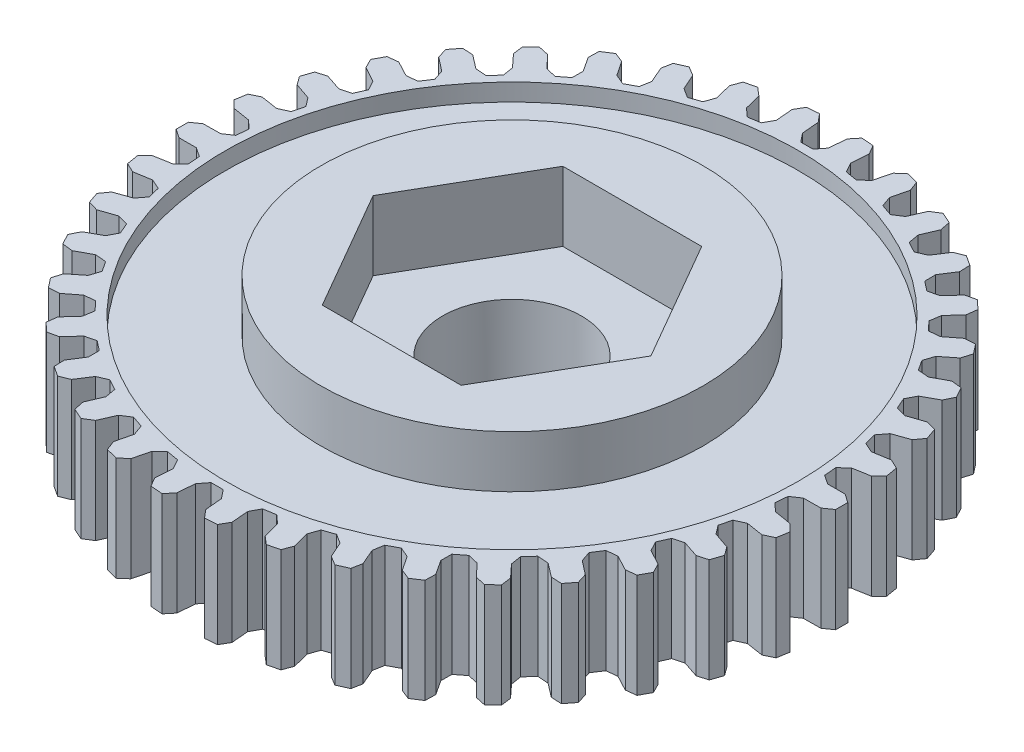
SolidWorks part; units mm, degrees
ref_plane "Front" through (0, 0, 0) normal (0, 0, 1) x (1, 0, 0)
ref_plane "Top" through (0, 0, 0) normal (0, 1, 0) x (1, 0, 0)
ref_plane "Right" through (0, 0, 0) normal (1, 0, 0) x (0, 0, -1)
sketch "Sketch1" plane through (0, 0, 0) normal (0, 0, 1) x (1, 0, 0)
  line L0 (0, 0) -> (0, 4)
  line L2 (8.25, 3) -> (8.25, 2.5)
  line L3 (9.5, 3) -> (8.25, 3)
  line L4 (9.5, 0) -> (9.5, 3)
  line L5 (8.25, 2.5) -> (5.5, 2.5)
  line L6 (5.5, 2.5) -> (5.5, 4)
  line L7 (0, 4) -> (5.5, 4)
  line L8 (9.5, 0) -> (8.25, 0)
  line L9 (8.25, 0) -> (8.25, 0.5)
  line L10 (8.25, 0.5) -> (5.25, 0.5)
  line L11 (5.25, 0.5) -> (5.25, 0)
  line L12 (5.25, 0) -> (0, 0)
  dimension "D1" = 3
  dimension "D2" = 1.5
  dimension "D3" = 4
  dimension "D4" = 5.5
  dimension "D5" = 1.25
  dimension "D6" = 9.5
  dimension "D7" = 3
  dimension "D8" = 1.25
  dimension "D9" = 0.5
  dimension "D10" = 5.25
  dimension "D11" = 0.5
revolve "Revolve1" add sketch "Sketch1" angle 360 about L0
sketch "Sketch3" plane through (0, 3, 0) normal (0, 1, 0) x (-1, 0, 0)
  line L0 (2.1568, 9.2453) -> (1.9273, 9.0458)
  line L1 (1.9273, 9.0458) -> (1.8053, 8.5613)
  line L2 (1.8053, 8.5613) -> (1.5711, 8.348)
  line L3 (1.5711, 8.348) -> (1.2246, 8.4058)
  line L4 (1.2246, 8.4058) -> (1.0699, 8.6838)
  line L5 (1.0699, 8.6838) -> (1.1068, 9.1821)
  line L6 (1.1068, 9.1821) -> (0.9521, 9.4455)
  line L7 (0.9521, 9.4455) -> (0.6057, 9.4742)
  line L8 (0.6057, 9.4742) -> (0.4122, 9.2396)
  line L9 (0.4122, 9.2396) -> (0.3716, 8.7417)
  line L10 (0.3716, 8.7417) -> (0.1756, 8.4927)
  line L11 (0.1756, 8.4927) -> (-0.1756, 8.4927)
  line L12 (-0.1756, 8.4927) -> (-0.3741, 8.7415)
  line L13 (-0.3741, 8.7415) -> (-0.4196, 9.239)
  line L14 (-0.4196, 9.239) -> (-0.6156, 9.4734)
  line L15 (-0.6156, 9.4734) -> (-0.962, 9.4447)
  line L16 (3.6491, 8.7642) -> (3.3899, 8.6052)
  line L17 (3.3899, 8.6052) -> (3.1899, 8.1474)
  line L18 (3.1899, 8.1474) -> (2.9237, 7.9756)
  line L19 (2.9237, 7.9756) -> (2.5915, 8.0896)
  line L20 (2.5915, 8.0896) -> (2.4846, 8.3893)
  line L21 (2.4846, 8.3893) -> (2.603, 8.8747)
  line L22 (2.603, 8.8747) -> (2.4937, 9.16)
  line L23 (2.4937, 9.16) -> (2.1568, 9.2453)
  line L24 (5.0419, 8.0441) -> (4.7601, 7.9298)
  line L25 (4.7601, 7.9298) -> (4.4874, 7.5113)
  line L26 (4.4874, 7.5113) -> (4.1966, 7.3855)
  line L27 (4.1966, 7.3855) -> (3.8876, 7.5527)
  line L28 (3.8876, 7.5527) -> (3.8315, 7.8659)
  line L29 (3.8315, 7.8659) -> (4.0282, 8.3252)
  line L30 (4.0282, 8.3252) -> (3.9674, 8.6246)
  line L31 (3.9674, 8.6246) -> (3.6491, 8.7642)
  line L32 (6.2971, 7.1045) -> (6.0003, 7.0382)
  line L33 (6.0003, 7.0382) -> (5.6625, 6.6702)
  line L34 (5.6625, 6.6702) -> (5.3549, 6.5941)
  line L35 (5.3549, 6.5941) -> (5.0778, 6.8098)
  line L36 (5.0778, 6.8098) -> (5.074, 7.128)
  line L37 (5.074, 7.128) -> (5.3436, 7.5486)
  line L38 (5.3436, 7.5486) -> (5.3329, 7.854)
  line L39 (5.3329, 7.854) -> (5.0419, 8.0441)
  line L40 (7.3806, 5.9711) -> (7.077, 5.9546)
  line L41 (7.077, 5.9546) -> (6.6831, 5.6472)
  line L42 (6.6831, 5.6472) -> (6.3673, 5.6228)
  line L43 (6.3673, 5.6228) -> (6.1294, 5.8812)
  line L44 (6.1294, 5.8812) -> (6.178, 6.1957)
  line L45 (6.178, 6.1957) -> (6.5131, 6.5661)
  line L46 (6.5131, 6.5661) -> (6.5529, 6.8691)
  line L47 (6.5529, 6.8691) -> (6.2971, 7.1045)
  line L48 (8.2628, 4.6749) -> (7.9605, 4.7086)
  line L49 (7.9605, 4.7086) -> (7.5215, 4.4702)
  line L50 (7.5215, 4.4702) -> (7.2059, 4.4981)
  line L51 (7.2059, 4.4981) -> (7.0138, 4.7921)
  line L52 (7.0138, 4.7921) -> (7.1135, 5.0943)
  line L53 (7.1135, 5.0943) -> (7.5051, 5.4046)
  line L54 (7.5051, 5.4046) -> (7.5941, 5.6968)
  line L55 (7.5941, 5.6968) -> (7.3806, 5.9711)
  line L56 (8.9195, 3.2511) -> (8.627, 3.3341)
  line L57 (8.627, 3.3341) -> (8.1547, 3.1712)
  line L58 (8.1547, 3.1712) -> (7.848, 3.2507)
  line L59 (7.848, 3.2507) -> (7.7069, 3.5723)
  line L60 (7.7069, 3.5723) -> (7.855, 3.854)
  line L61 (7.855, 3.854) -> (8.2923, 4.0955)
  line L62 (8.2923, 4.0955) -> (8.4282, 4.3692)
  line L63 (8.4282, 4.3692) -> (8.2628, 4.6749)
  line L64 (9.333, 1.7387) -> (9.0581, 1.8687)
  line L65 (9.0581, 1.8687) -> (8.5654, 1.7858)
  line L66 (8.5654, 1.7858) -> (8.276, 1.9146)
  line L67 (8.276, 1.9146) -> (8.1897, 2.2551)
  line L68 (8.1897, 2.2551) -> (8.3822, 2.5085)
  line L69 (8.3822, 2.5085) -> (8.8533, 2.6748)
  line L70 (8.8533, 2.6748) -> (9.0324, 2.9224)
  line L71 (9.0324, 2.9224) -> (8.9195, 3.2511)
  line L72 (9.4919, 0.1788) -> (9.2421, 0.3523)
  line L73 (9.2421, 0.3523) -> (8.7425, 0.3516)
  line L74 (8.7425, 0.3516) -> (8.4782, 0.5263)
  line L75 (8.4782, 0.5263) -> (8.4492, 0.8764)
  line L76 (8.4492, 0.8764) -> (8.6807, 1.0946)
  line L77 (8.6807, 1.0946) -> (9.1728, 1.1811)
  line L78 (9.1728, 1.1811) -> (9.3902, 1.3958)
  line L79 (9.3902, 1.3958) -> (9.333, 1.7387)
  line L80 (9.3919, -1.386) -> (9.174, -1.1737)
  line L81 (9.174, -1.1737) -> (8.6812, -1.0922)
  line L82 (8.6812, -1.0922) -> (8.4492, -0.8764)
  line L83 (8.4492, -0.8764) -> (8.4782, -0.5263)
  line L84 (8.4782, -0.5263) -> (8.7425, -0.3491)
  line L85 (8.7425, -0.3491) -> (9.2421, -0.3448)
  line L86 (9.2421, -0.3448) -> (9.4919, -0.1688)
  line L87 (9.4919, -0.1688) -> (9.4919, 0.1788)
  line L88 (9.0356, -2.9129) -> (8.8557, -2.6677)
  line L89 (8.8557, -2.6677) -> (8.383, -2.5062)
  line L90 (8.383, -2.5062) -> (8.1897, -2.2551)
  line L91 (8.1897, -2.2551) -> (8.276, -1.9146)
  line L92 (8.276, -1.9146) -> (8.5658, -1.7833)
  line L93 (8.5658, -1.7833) -> (9.0593, -1.8613)
  line L94 (9.0593, -1.8613) -> (9.3346, -1.7288)
  line L95 (9.3346, -1.7288) -> (9.3919, -1.386)
  line L96 (8.433, -4.3604) -> (8.2958, -4.089)
  line L97 (8.2958, -4.089) -> (7.8562, -3.8518)
  line L98 (7.8562, -3.8518) -> (7.7069, -3.5723)
  line L99 (7.7069, -3.5723) -> (7.848, -3.2507)
  line L100 (7.848, -3.2507) -> (8.1555, -3.1689)
  line L101 (8.1555, -3.1689) -> (8.6294, -3.327)
  line L102 (8.6294, -3.327) -> (8.9228, -3.2417)
  line L103 (8.9228, -3.2417) -> (9.0356, -2.9129)
  line L104 (7.6002, -5.6889) -> (7.5097, -5.3986)
  line L105 (7.5097, -5.3986) -> (7.115, -5.0923)
  line L106 (7.115, -5.0923) -> (7.0138, -4.7921)
  line L107 (7.0138, -4.7921) -> (7.2059, -4.4981)
  line L108 (7.2059, -4.4981) -> (7.5227, -4.468)
  line L109 (7.5227, -4.468) -> (7.9641, -4.702)
  line L110 (7.9641, -4.702) -> (8.2675, -4.6661)
  line L111 (8.2675, -4.6661) -> (8.433, -4.3604)
  line L112 (6.5602, -6.8623) -> (6.5187, -6.5611)
  line L113 (6.5187, -6.5611) -> (6.1798, -6.194)
  line L114 (6.1798, -6.194) -> (6.1294, -5.8812)
  line L115 (6.1294, -5.8812) -> (6.3673, -5.6228)
  line L116 (6.3673, -5.6228) -> (6.6847, -5.6453)
  line L117 (6.6847, -5.6453) -> (7.0816, -5.9487)
  line L118 (7.0816, -5.9487) -> (7.3868, -5.9632)
  line L119 (7.3868, -5.9632) -> (7.6002, -5.6889)
  line L120 (5.3412, -7.8485) -> (5.3498, -7.5445)
  line L121 (5.3498, -7.5445) -> (5.0761, -7.1266)
  line L122 (5.0761, -7.1266) -> (5.0778, -6.8098)
  line L123 (5.0778, -6.8098) -> (5.3549, -6.5941)
  line L124 (5.3549, -6.5941) -> (5.6643, -6.6685)
  line L125 (5.6643, -6.6685) -> (6.0059, -7.0331)
  line L126 (6.0059, -7.0331) -> (6.3045, -7.0977)
  line L127 (6.3045, -7.0977) -> (6.5602, -6.8623)
  line L128 (3.9766, -8.6206) -> (4.0351, -8.3222)
  line L129 (4.0351, -8.3222) -> (3.8338, -7.8649)
  line L130 (3.8338, -7.8649) -> (3.8876, -7.5527)
  line L131 (3.8876, -7.5527) -> (4.1966, -7.3855)
  line L132 (4.1966, -7.3855) -> (4.4895, -7.5099)
  line L133 (4.4895, -7.5099) -> (4.7663, -7.9257)
  line L134 (4.7663, -7.9257) -> (5.0503, -8.0386)
  line L135 (5.0503, -8.0386) -> (5.3412, -7.8485)
  line L136 (2.5034, -9.1575) -> (2.6103, -8.8728)
  line L137 (2.6103, -8.8728) -> (2.487, -8.3887)
  line L138 (2.487, -8.3887) -> (2.5915, -8.0896)
  line L139 (2.5915, -8.0896) -> (2.9237, -7.9756)
  line L140 (2.9237, -7.9756) -> (3.1921, -8.1464)
  line L141 (3.1921, -8.1464) -> (3.3968, -8.6022)
  line L142 (3.3968, -8.6022) -> (3.6583, -8.7602)
  line L143 (3.6583, -8.7602) -> (3.9766, -8.6206)
  line L144 (0.962, -9.4447) -> (1.1143, -9.1814)
  line L145 (1.1143, -9.1814) -> (1.0723, -8.6836)
  line L146 (1.0723, -8.6836) -> (1.2246, -8.4058)
  line L147 (1.2246, -8.4058) -> (1.5711, -8.348)
  line L148 (1.5711, -8.348) -> (1.8078, -8.5607)
  line L149 (1.8078, -8.5607) -> (1.9346, -9.0439)
  line L150 (1.9346, -9.0439) -> (2.1665, -9.2429)
  line L151 (2.1665, -9.2429) -> (2.5034, -9.1575)
  line L152 (-0.6057, -9.4742) -> (-0.4122, -9.2396)
  line L153 (-0.4122, -9.2396) -> (-0.3716, -8.7417)
  line L154 (-0.3716, -8.7417) -> (-0.1756, -8.4927)
  line L155 (-0.1756, -8.4927) -> (0.1756, -8.4927)
  line L156 (0.1756, -8.4927) -> (0.3741, -8.7415)
  line L157 (0.3741, -8.7415) -> (0.4196, -9.239)
  line L158 (0.4196, -9.239) -> (0.6156, -9.4734)
  line L159 (0.6156, -9.4734) -> (0.962, -9.4447)
  line L160 (-2.1568, -9.2453) -> (-1.9273, -9.0458)
  line L161 (-1.9273, -9.0458) -> (-1.8053, -8.5613)
  line L162 (-1.8053, -8.5613) -> (-1.5711, -8.348)
  line L163 (-1.5711, -8.348) -> (-1.2246, -8.4058)
  line L164 (-1.2246, -8.4058) -> (-1.0699, -8.6838)
  line L165 (-1.0699, -8.6838) -> (-1.1068, -9.1821)
  line L166 (-1.1068, -9.1821) -> (-0.9521, -9.4455)
  line L167 (-0.9521, -9.4455) -> (-0.6057, -9.4742)
  line L168 (-3.6491, -8.7642) -> (-3.3899, -8.6052)
  line L169 (-3.3899, -8.6052) -> (-3.1899, -8.1474)
  line L170 (-3.1899, -8.1474) -> (-2.9237, -7.9756)
  line L171 (-2.9237, -7.9756) -> (-2.5915, -8.0896)
  line L172 (-2.5915, -8.0896) -> (-2.4846, -8.3893)
  line L173 (-2.4846, -8.3893) -> (-2.603, -8.8747)
  line L174 (-2.603, -8.8747) -> (-2.4937, -9.16)
  line L175 (-2.4937, -9.16) -> (-2.1568, -9.2453)
  line L176 (-5.0419, -8.0441) -> (-4.7601, -7.9298)
  line L177 (-4.7601, -7.9298) -> (-4.4874, -7.5113)
  line L178 (-4.4874, -7.5113) -> (-4.1966, -7.3855)
  line L179 (-4.1966, -7.3855) -> (-3.8876, -7.5527)
  line L180 (-3.8876, -7.5527) -> (-3.8315, -7.8659)
  line L181 (-3.8315, -7.8659) -> (-4.0282, -8.3252)
  line L182 (-4.0282, -8.3252) -> (-3.9674, -8.6246)
  line L183 (-3.9674, -8.6246) -> (-3.6491, -8.7642)
  line L184 (-6.2971, -7.1045) -> (-6.0003, -7.0382)
  line L185 (-6.0003, -7.0382) -> (-5.6625, -6.6702)
  line L186 (-5.6625, -6.6702) -> (-5.3549, -6.5941)
  line L187 (-5.3549, -6.5941) -> (-5.0778, -6.8098)
  line L188 (-5.0778, -6.8098) -> (-5.074, -7.128)
  line L189 (-5.074, -7.128) -> (-5.3436, -7.5486)
  line L190 (-5.3436, -7.5486) -> (-5.3329, -7.854)
  line L191 (-5.3329, -7.854) -> (-5.0419, -8.0441)
  line L192 (-7.3806, -5.9711) -> (-7.077, -5.9546)
  line L193 (-7.077, -5.9546) -> (-6.6831, -5.6472)
  line L194 (-6.6831, -5.6472) -> (-6.3673, -5.6228)
  line L195 (-6.3673, -5.6228) -> (-6.1294, -5.8812)
  line L196 (-6.1294, -5.8812) -> (-6.178, -6.1957)
  line L197 (-6.178, -6.1957) -> (-6.5131, -6.5661)
  line L198 (-6.5131, -6.5661) -> (-6.5529, -6.8691)
  line L199 (-6.5529, -6.8691) -> (-6.2971, -7.1045)
  line L200 (-8.2628, -4.6749) -> (-7.9605, -4.7086)
  line L201 (-7.9605, -4.7086) -> (-7.5215, -4.4702)
  line L202 (-7.5215, -4.4702) -> (-7.2059, -4.4981)
  line L203 (-7.2059, -4.4981) -> (-7.0138, -4.7921)
  line L204 (-7.0138, -4.7921) -> (-7.1135, -5.0943)
  line L205 (-7.1135, -5.0943) -> (-7.5051, -5.4046)
  line L206 (-7.5051, -5.4046) -> (-7.5941, -5.6968)
  line L207 (-7.5941, -5.6968) -> (-7.3806, -5.9711)
  line L208 (-8.9195, -3.2511) -> (-8.627, -3.3341)
  line L209 (-8.627, -3.3341) -> (-8.1547, -3.1712)
  line L210 (-8.1547, -3.1712) -> (-7.848, -3.2507)
  line L211 (-7.848, -3.2507) -> (-7.7069, -3.5723)
  line L212 (-7.7069, -3.5723) -> (-7.855, -3.854)
  line L213 (-7.855, -3.854) -> (-8.2923, -4.0955)
  line L214 (-8.2923, -4.0955) -> (-8.4282, -4.3692)
  line L215 (-8.4282, -4.3692) -> (-8.2628, -4.6749)
  line L216 (-9.333, -1.7387) -> (-9.0581, -1.8687)
  line L217 (-9.0581, -1.8687) -> (-8.5654, -1.7858)
  line L218 (-8.5654, -1.7858) -> (-8.276, -1.9146)
  line L219 (-8.276, -1.9146) -> (-8.1897, -2.2551)
  line L220 (-8.1897, -2.2551) -> (-8.3822, -2.5085)
  line L221 (-8.3822, -2.5085) -> (-8.8533, -2.6748)
  line L222 (-8.8533, -2.6748) -> (-9.0324, -2.9224)
  line L223 (-9.0324, -2.9224) -> (-8.9195, -3.2511)
  line L224 (-9.4919, -0.1788) -> (-9.2421, -0.3523)
  line L225 (-9.2421, -0.3523) -> (-8.7425, -0.3516)
  line L226 (-8.7425, -0.3516) -> (-8.4782, -0.5263)
  line L227 (-8.4782, -0.5263) -> (-8.4492, -0.8764)
  line L228 (-8.4492, -0.8764) -> (-8.6807, -1.0946)
  line L229 (-8.6807, -1.0946) -> (-9.1728, -1.1811)
  line L230 (-9.1728, -1.1811) -> (-9.3902, -1.3958)
  line L231 (-9.3902, -1.3958) -> (-9.333, -1.7387)
  line L232 (-9.3919, 1.386) -> (-9.174, 1.1737)
  line L233 (-9.174, 1.1737) -> (-8.6812, 1.0922)
  line L234 (-8.6812, 1.0922) -> (-8.4492, 0.8764)
  line L235 (-8.4492, 0.8764) -> (-8.4782, 0.5263)
  line L236 (-8.4782, 0.5263) -> (-8.7425, 0.3491)
  line L237 (-8.7425, 0.3491) -> (-9.2421, 0.3448)
  line L238 (-9.2421, 0.3448) -> (-9.4919, 0.1688)
  line L239 (-9.4919, 0.1688) -> (-9.4919, -0.1788)
  line L240 (-9.0356, 2.9129) -> (-8.8557, 2.6677)
  line L241 (-8.8557, 2.6677) -> (-8.383, 2.5062)
  line L242 (-8.383, 2.5062) -> (-8.1897, 2.2551)
  line L243 (-8.1897, 2.2551) -> (-8.276, 1.9146)
  line L244 (-8.276, 1.9146) -> (-8.5658, 1.7833)
  line L245 (-8.5658, 1.7833) -> (-9.0593, 1.8613)
  line L246 (-9.0593, 1.8613) -> (-9.3346, 1.7288)
  line L247 (-9.3346, 1.7288) -> (-9.3919, 1.386)
  line L248 (-8.433, 4.3604) -> (-8.2958, 4.089)
  line L249 (-8.2958, 4.089) -> (-7.8562, 3.8518)
  line L250 (-7.8562, 3.8518) -> (-7.7069, 3.5723)
  line L251 (-7.7069, 3.5723) -> (-7.848, 3.2507)
  line L252 (-7.848, 3.2507) -> (-8.1555, 3.1689)
  line L253 (-8.1555, 3.1689) -> (-8.6294, 3.327)
  line L254 (-8.6294, 3.327) -> (-8.9228, 3.2417)
  line L255 (-8.9228, 3.2417) -> (-9.0356, 2.9129)
  line L256 (-7.6002, 5.6889) -> (-7.5097, 5.3986)
  line L257 (-7.5097, 5.3986) -> (-7.115, 5.0923)
  line L258 (-7.115, 5.0923) -> (-7.0138, 4.7921)
  line L259 (-7.0138, 4.7921) -> (-7.2059, 4.4981)
  line L260 (-7.2059, 4.4981) -> (-7.5227, 4.468)
  line L261 (-7.5227, 4.468) -> (-7.9641, 4.702)
  line L262 (-7.9641, 4.702) -> (-8.2675, 4.6661)
  line L263 (-8.2675, 4.6661) -> (-8.433, 4.3604)
  line L264 (-6.5602, 6.8623) -> (-6.5187, 6.5611)
  line L265 (-6.5187, 6.5611) -> (-6.1798, 6.194)
  line L266 (-6.1798, 6.194) -> (-6.1294, 5.8812)
  line L267 (-6.1294, 5.8812) -> (-6.3673, 5.6228)
  line L268 (-6.3673, 5.6228) -> (-6.6847, 5.6453)
  line L269 (-6.6847, 5.6453) -> (-7.0816, 5.9487)
  line L270 (-7.0816, 5.9487) -> (-7.3868, 5.9632)
  line L271 (-7.3868, 5.9632) -> (-7.6002, 5.6889)
  line L272 (-5.3412, 7.8485) -> (-5.3498, 7.5445)
  line L273 (-5.3498, 7.5445) -> (-5.0761, 7.1266)
  line L274 (-5.0761, 7.1266) -> (-5.0778, 6.8098)
  line L275 (-5.0778, 6.8098) -> (-5.3549, 6.5941)
  line L276 (-5.3549, 6.5941) -> (-5.6643, 6.6685)
  line L277 (-5.6643, 6.6685) -> (-6.0059, 7.0331)
  line L278 (-6.0059, 7.0331) -> (-6.3045, 7.0977)
  line L279 (-6.3045, 7.0977) -> (-6.5602, 6.8623)
  line L280 (-3.9766, 8.6206) -> (-4.0351, 8.3222)
  line L281 (-4.0351, 8.3222) -> (-3.8338, 7.8649)
  line L282 (-3.8338, 7.8649) -> (-3.8876, 7.5527)
  line L283 (-3.8876, 7.5527) -> (-4.1966, 7.3855)
  line L284 (-4.1966, 7.3855) -> (-4.4895, 7.5099)
  line L285 (-4.4895, 7.5099) -> (-4.7663, 7.9257)
  line L286 (-4.7663, 7.9257) -> (-5.0503, 8.0386)
  line L287 (-5.0503, 8.0386) -> (-5.3412, 7.8485)
  line L288 (-2.5034, 9.1575) -> (-2.6103, 8.8728)
  line L289 (-2.6103, 8.8728) -> (-2.487, 8.3887)
  line L290 (-2.487, 8.3887) -> (-2.5915, 8.0896)
  line L291 (-2.5915, 8.0896) -> (-2.9237, 7.9756)
  line L292 (-2.9237, 7.9756) -> (-3.1921, 8.1464)
  line L293 (-3.1921, 8.1464) -> (-3.3968, 8.6022)
  line L294 (-3.3968, 8.6022) -> (-3.6583, 8.7602)
  line L295 (-3.6583, 8.7602) -> (-3.9766, 8.6206)
  line L296 (-0.962, 9.4447) -> (-1.1143, 9.1814)
  line L297 (-1.1143, 9.1814) -> (-1.0723, 8.6836)
  line L298 (-1.0723, 8.6836) -> (-1.2246, 8.4058)
  line L299 (-1.2246, 8.4058) -> (-1.5711, 8.348)
  line L300 (-1.5711, 8.348) -> (-1.8078, 8.5607)
  line L301 (-1.8078, 8.5607) -> (-1.9346, 9.0439)
  line L302 (-1.9346, 9.0439) -> (-2.1665, 9.2429)
  line L303 (-2.1665, 9.2429) -> (-2.5034, 9.1575)
  circle A0 centre (0, 0) radius 9.5
extrude "Cut-Extrude2" cut sketch "Sketch3" against normal through all
sketch "Sketch6" plane through (0, 4, 0) normal (0, 1, 0) x (-1, 0, 0)
  circle A0 centre (0, 0) radius 2
extrude "Cut-Extrude5" cut sketch "Sketch6" against normal through all
sketch "Sketch7" plane through (0, 4, 0) normal (0, 1, 0) x (-1, 0, 0)
  line L1 (-4, 0) -> (-2, -3.4641)
  line L2 (-2, -3.4641) -> (2, -3.4641)
  line L3 (2, -3.4641) -> (4, 0)
  line L4 (4, 0) -> (2, 3.4641)
  line L5 (2, 3.4641) -> (-2, 3.4641)
  line L6 (-2, 3.4641) -> (-4, 0)
  circle A0 centre (0, 0) radius 3.4641 construction
  dimension "D1" = 4
extrude "Cut-Extrude6" cut sketch "Sketch7" against normal blind 2
